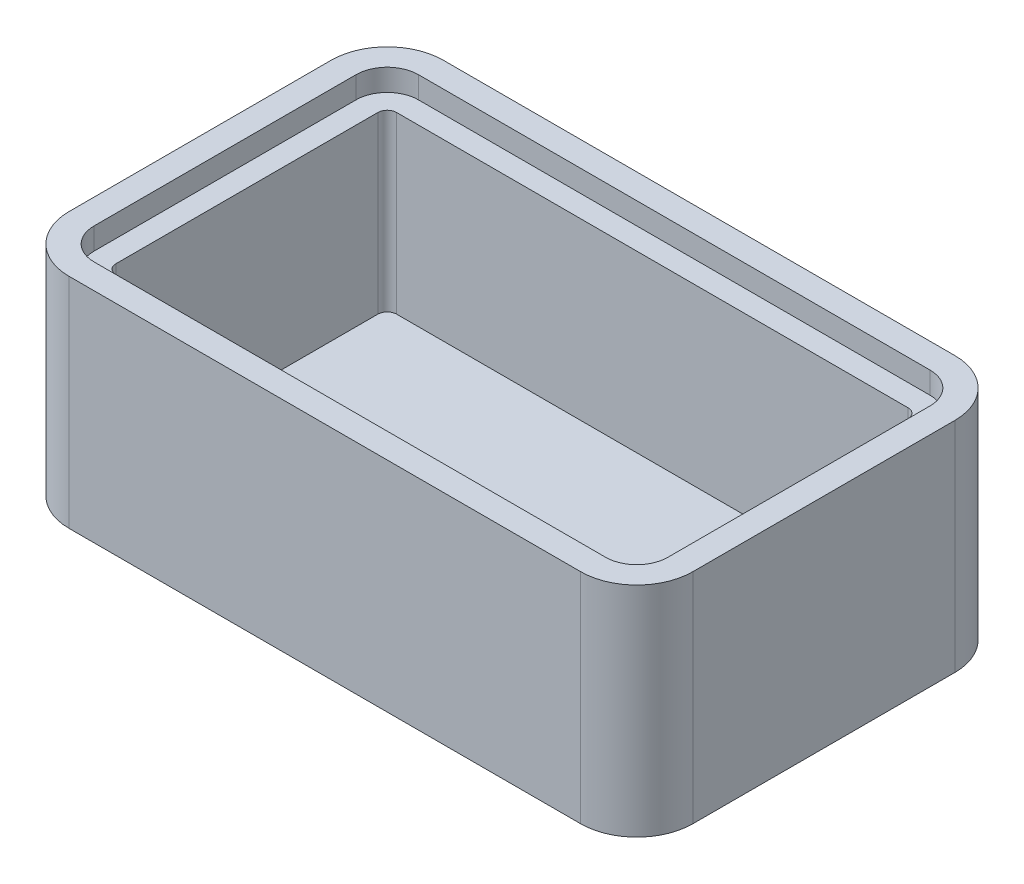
SolidWorks part; units mm, degrees
ref_plane "Front Plane" through (0, 0, 0) normal (0, 0, 1) x (1, 0, 0)
ref_plane "Top Plane" through (0, 0, 0) normal (0, 1, 0) x (1, 0, 0)
ref_plane "Right Plane" through (0, 0, 0) normal (1, 0, 0) x (0, 0, -1)
sketch "Sketch1" plane through (0, 0, 0) normal (0, 1, 0) x (1, 0, 0)
  line L1 (0, 0) -> (127, 0)
  line L2 (0, 0) -> (0, 76.2)
  line L3 (0, 76.2) -> (127, 76.2)
  line L4 (127, 0) -> (127, 76.2)
  dimension "D1" = 76.2
  dimension "D2" = 127
extrude "Extrude1" add sketch "Sketch1" along normal blind 44.45
fillet "Fillet1" radius 11.43 4 edges at (127, 22.225, -76.2) (127, 22.225, 0) (0, 22.225, -76.2) (0, 22.225, 0)
sketch "Sketch2" plane through (0, 44.45, 0) normal (0, 1, 0) x (-1, 0, 0)
  line L8 (-121.92, -11.43) -> (-121.92, -64.77)
  line L9 (-115.57, -71.12) -> (-11.43, -71.12)
  line L10 (-5.08, -64.77) -> (-5.08, -11.43)
  line L11 (-11.43, -5.08) -> (-115.57, -5.08)
  line L12 (-121.92, -11.43) -> (-121.92, -64.77)
  line L13 (-115.57, -71.12) -> (-11.43, -71.12)
  line L14 (-5.08, -64.77) -> (-5.08, -11.43)
  line L15 (-11.43, -5.08) -> (-115.57, -5.08)
  arc A8 (-121.92, -64.77) -> (-115.57, -71.12) centre (-115.57, -64.77) ccw
  arc A9 (-11.43, -71.12) -> (-5.08, -64.77) centre (-11.43, -64.77) ccw
  arc A10 (-5.08, -11.43) -> (-11.43, -5.08) centre (-11.43, -11.43) ccw
  arc A11 (-115.57, -5.08) -> (-121.92, -11.43) centre (-115.57, -11.43) ccw
  arc A12 (-121.92, -64.77) -> (-115.57, -71.12) centre (-115.57, -64.77) ccw
  arc A13 (-11.43, -71.12) -> (-5.08, -64.77) centre (-11.43, -64.77) ccw
  arc A14 (-5.08, -11.43) -> (-11.43, -5.08) centre (-11.43, -11.43) ccw
  arc A15 (-115.57, -5.08) -> (-121.92, -11.43) centre (-115.57, -11.43) ccw
  dimension "D1" = 5.08
extrude "Cut-Extrude1" cut sketch "Sketch2" against normal blind 4.445
sketch "Sketch3" plane through (0, 40.005, 0) normal (0, 1, 0) x (-1, 0, 0)
  line L8 (-117.475, -11.43) -> (-117.475, -64.77)
  line L9 (-115.57, -66.675) -> (-11.43, -66.675)
  line L10 (-9.525, -64.77) -> (-9.525, -11.43)
  line L11 (-11.43, -9.525) -> (-115.57, -9.525)
  line L12 (-117.475, -11.43) -> (-117.475, -64.77)
  line L13 (-115.57, -66.675) -> (-11.43, -66.675)
  line L14 (-9.525, -64.77) -> (-9.525, -11.43)
  line L15 (-11.43, -9.525) -> (-115.57, -9.525)
  arc A8 (-115.57, -9.525) -> (-117.475, -11.43) centre (-115.57, -11.43) ccw
  arc A9 (-117.475, -64.77) -> (-115.57, -66.675) centre (-115.57, -64.77) ccw
  arc A10 (-11.43, -66.675) -> (-9.525, -64.77) centre (-11.43, -64.77) ccw
  arc A11 (-9.525, -11.43) -> (-11.43, -9.525) centre (-11.43, -11.43) ccw
  arc A12 (-115.57, -9.525) -> (-117.475, -11.43) centre (-115.57, -11.43) ccw
  arc A13 (-117.475, -64.77) -> (-115.57, -66.675) centre (-115.57, -64.77) ccw
  arc A14 (-11.43, -66.675) -> (-9.525, -64.77) centre (-11.43, -64.77) ccw
  arc A15 (-9.525, -11.43) -> (-11.43, -9.525) centre (-11.43, -11.43) ccw
  dimension "D1" = 4.445
extrude "Cut-Extrude2" cut sketch "Sketch3" against normal offset from surface (35.56 mm away) 4.445
